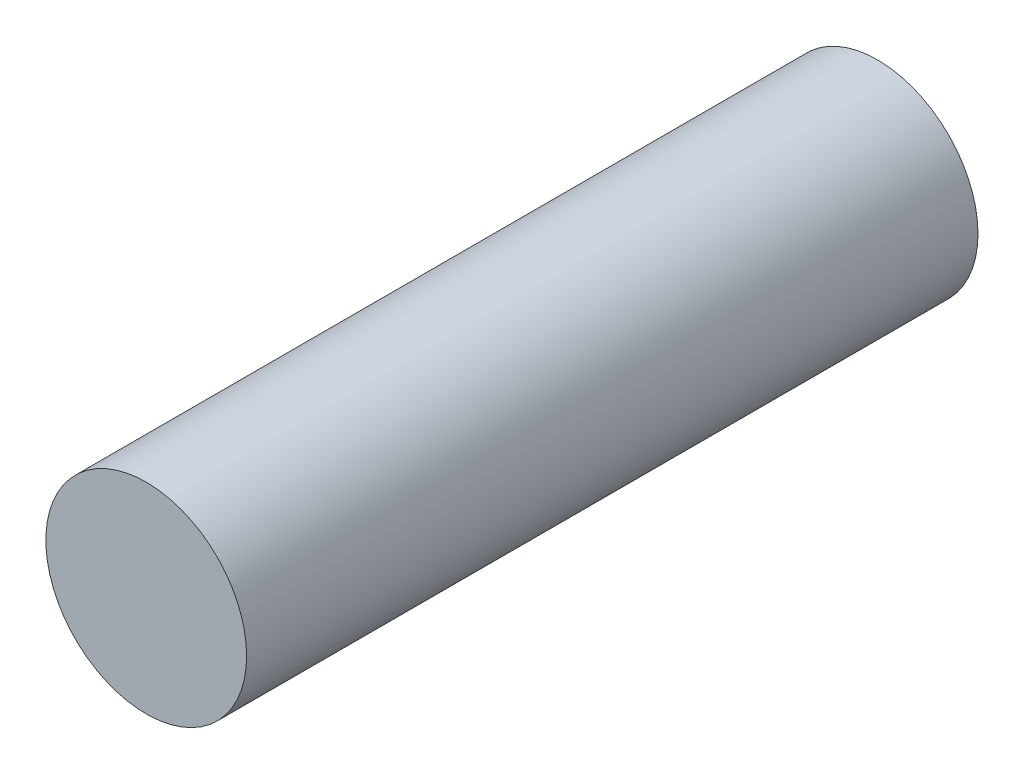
SolidWorks part; units mm, degrees
ref_plane "Front Plane" through (0, 0, 0) normal (0, 0, 1) x (1, 0, 0)
ref_plane "Top Plane" through (0, 0, 0) normal (0, 1, 0) x (1, 0, 0)
ref_plane "Right Plane" through (0, 0, 0) normal (1, 0, 0) x (0, 0, -1)
sketch "Sketch1" plane through (0, 0, 0) normal (0, 0, 1) x (1, 0, 0)
  circle A0 centre (0, 0) radius 14
  dimension "D1" = 28
extrude "Boss-Extrude1" add sketch "Sketch1" along normal mid plane 102
sketch "Sketch2" plane through (0, 0, 51) normal (0, 0, 1) x (1, 0, 0)
  circle A0 centre (0, 0) radius 11.5
  circle A1 centre (0, 0) radius 14 construction
  point P15 (0, 14)
  dimension "D1" = 2.5
